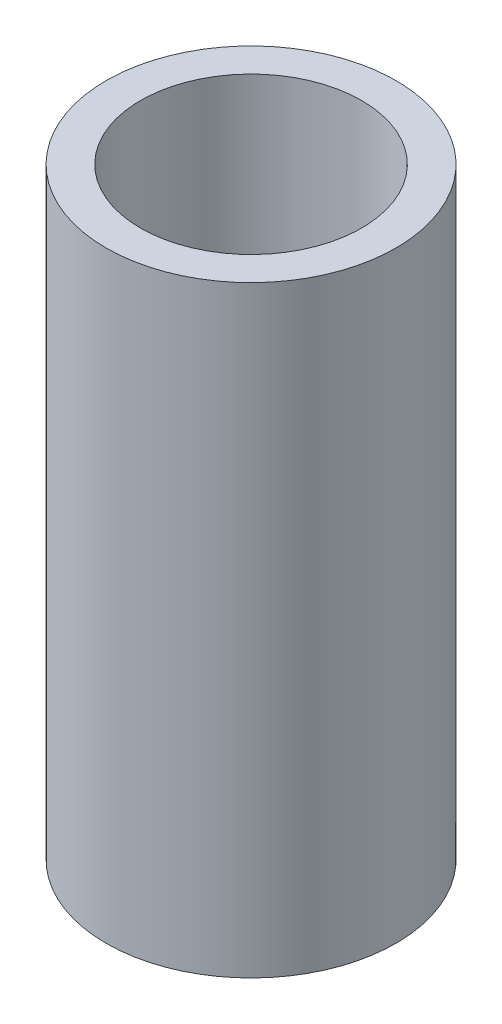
SolidWorks part; units mm, degrees
ref_plane "Plan de face" through (0, 0, 0) normal (0, 0, 1) x (1, 0, 0)
ref_plane "Plan de dessus" through (0, 0, 0) normal (0, 1, 0) x (1, 0, 0)
ref_plane "Plan de droite" through (0, 0, 0) normal (1, 0, 0) x (0, 0, -1)
sketch "Esquisse1" plane through (0, 0, 0) normal (0, 0, 1) x (1, 0, 0)
  line L0 (-711.8853, 1394.6395) -> (-711.8853, 1133.9495) construction
  line L1 (-711.8853, 1230.0977) -> (-711.8853, 1382) construction
  line L2 (-517.3378, 1279) -> (-711.8853, 1279) construction
  line L3 (-728.7353, 1314) -> (-724.7353, 1314)
  line L4 (-728.7353, 1314) -> (-728.7353, 1244)
  line L5 (-728.7353, 1244) -> (-724.7353, 1244)
  line L6 (-724.7353, 1314) -> (-724.7353, 1244)
  dimension "D1" = 35
  dimension "D2" = 70
  dimension "D3" = 4
  dimension "D4" = 33.7
revolve "Révolution1" add sketch "Esquisse1" angle 360 about L0
